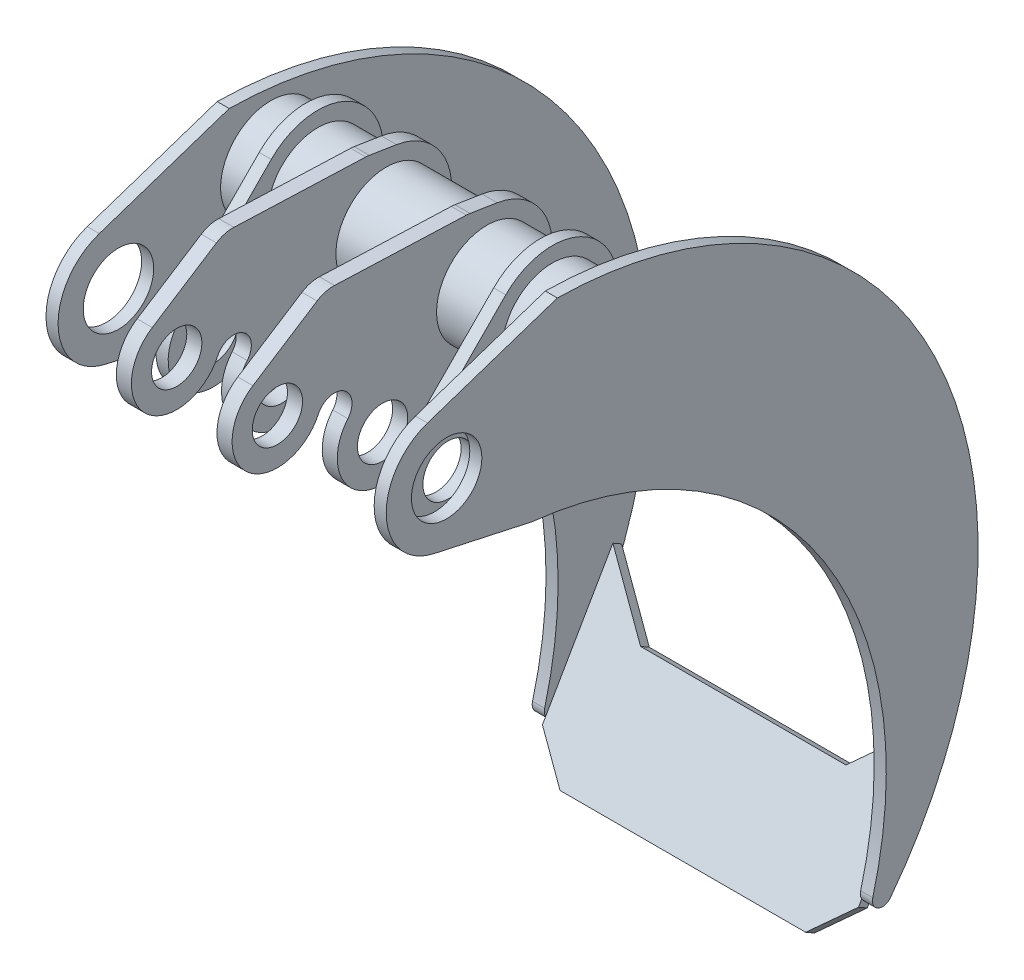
SolidWorks part; units mm, degrees
ref_plane "Ebene vorne" through (0, 0, 0) normal (0, 0, 1) x (1, 0, 0)
ref_plane "Ebene oben" through (0, 0, 0) normal (0, 1, 0) x (1, 0, 0)
ref_plane "Ebene rechts" through (0, 0, 0) normal (1, 0, 0) x (0, 0, -1)
sketch "Skizze1" plane through (0, 0, 0) normal (1, 0, 0) x (0, 0, -1)
  line L0 (-19.0085, 56.9094) -> (110, 100)
  line L1 (85, -80) -> (-12.8147, -58.6156)
  line L2 (0, 215) -> (0, -403.5076) construction
  line L3 (-634, 215) -> (-634, -403.5076) construction
  line L4 (-317, 60) -> (-317, -406.0306) construction
  line L5 (-1057, -221.2221) -> (-1057, -820.6828) construction
  line L6 (423, -221.2221) -> (423, -746.5071) construction
  line L7 (-664.6935, 100) -> (520.6037, 100) construction
  line L8 (-664.6935, 215) -> (531.2003, 215) construction
  line L9 (-811.8338, -695) -> (796.9006, -695) construction
  circle A0 centre (0, 0) radius 35
  arc A1 (-19.0085, 56.9094) -> (-12.8147, -58.6156) centre (0, 0) ccw
  arc A3 (423.3415, -572.6576) -> (440.9471, -581.3185) centre (433, -575.2486) ccw
  circle A7 centre (0, 0) radius 720 construction
  arc A8 (110, 100) -> (440.9471, -581.3185) centre (103.9883, -323.9574) cw
  arc A9 (423.3415, -572.6576) -> (85, -80) centre (43.7625, -470.8305) ccw
  point P18 (-634, 0)
  dimension "D1" = 70
  dimension "D2" = 60
  dimension "D8" = 10
  dimension "D9" = 1440
  dimension "D11" = 110
  dimension "D13" = 424
  dimension "D14" = 393
  dimension "D3" = 634
  dimension "D4" = 1480
  dimension "D5" = 100
  dimension "D6" = 115
  dimension "D7" = 910
  dimension "D10" = 180
  dimension "D12" = 85
extrude "Aufsatz-Linear austragen1" add sketch "Skizze1" along normal blind 12
sketch "Skizze2" plane through (12, 0, 0) normal (1, 0, 0) x (0, 0, -1)
  line L0 (412.3301, -621.0499) -> (499.8301, -469.4955)
  line L1 (412.3301, -621.0499) -> (403.6699, -616.0499)
  line L2 (499.8301, -469.4955) -> (491.1699, -464.4955)
  line L3 (403.6699, -616.0499) -> (491.1699, -464.4955)
  line L4 (495.5, -466.9955) -> (408, -618.5499) construction
  line L6 (423, -221.2221) -> (423, -746.5071) construction
  point P1 (433, -575.2486)
  dimension "D1" = 10
  dimension "D2" = 50
  dimension "D3" = 30
  dimension "D4" = 125
extrude "Aufsatz-Linear austragen2" add sketch "Skizze2" along normal blind 314
sketch "Skizze3" plane through (326, 0, 0) normal (1, 0, 0) x (0, 0, -1)
  line L5 (424.3397, -580.2486) -> (491.1699, -464.4955)
  line L6 (491.1699, -464.4955) -> (499.8301, -469.4955)
  line L7 (499.8301, -469.4955) -> (433, -585.2486)
  line L8 (110, 100) -> (-19.0085, 56.9094)
  line L9 (-12.8147, -58.6156) -> (85, -80)
  line L13 (110, 100) -> (-19.0085, 56.9094)
  line L14 (-12.8147, -58.6156) -> (85, -80)
  circle A0 centre (0, 0) radius 35 construction
  circle A1 centre (0, 0) radius 35
  arc A5 (433, -585.2486) -> (440.9471, -581.3185) centre (433, -575.2486) ccw
  arc A6 (440.9471, -581.3185) -> (110, 100) centre (103.9883, -323.9574) ccw
  arc A7 (-19.0085, 56.9094) -> (-12.8147, -58.6156) centre (0, 0) ccw
  arc A8 (423.3415, -572.6576) -> (85, -80) centre (43.7625, -470.8305) ccw
  arc A9 (423.3415, -572.6576) -> (424.3397, -580.2486) centre (433, -575.2486) ccw
  arc A10 (423.3415, -572.6576) -> (440.9471, -581.3185) centre (433, -575.2486) ccw
  arc A11 (440.9471, -581.3185) -> (110, 100) centre (103.9883, -323.9574) ccw
  arc A12 (-19.0085, 56.9094) -> (-12.8147, -58.6156) centre (0, 0) ccw
  arc A13 (423.3415, -572.6576) -> (85, -80) centre (43.7625, -470.8305) ccw
  dimension "D1" = 0
extrude "Aufsatz-Linear austragen3" add sketch "Skizze3" along normal blind 12
chamfer "Fase1" distance 35 angle 45 2 edges at (12, -618.5499, -408) (326, -618.5499, -408)
sketch "Skizze4" plane through (0, -333.8067, -578.1701) normal (0, -0.5, -0.866) x (-1, 0, 0)
  line L3 (-326, -296.6799) -> (-291, -331.6799) construction
  line L5 (-47, -331.6799) -> (-12, -296.6799) construction
  line L6 (-291, -331.6799) -> (-47, -331.6799) construction
  line L9 (-67, -211.6799) -> (-12, -156.6799)
  line L10 (-326, -156.6799) -> (-271, -211.6799)
  line L11 (-271, -211.6799) -> (-67, -211.6799)
  dimension "D1" = 120
extrude "Schnitt-Linear austragen1" cut sketch "Skizze4" against normal blind 10 and the other way through all
sketch "Skizze6" plane through (12, 0, 0) normal (1, 0, 0) x (0, 0, -1)
  circle A0 centre (151.4845, 36.1296) radius 50
  circle A1 centre (151.4845, 36.1296) radius 42
  circle A2 centre (0, 0) radius 155.7335 construction
  dimension "D1" = 100
  dimension "D2" = 8
  dimension "D3" = 311.4669
extrude "Aufsatz-Linear austragen8" add sketch "Skizze6" along normal up to next
ref_plane "Mitte" through (169, 0, 0) normal (1, 0, 0) x (0, 0, -1)
ref_plane "Ebene2" through (226.5, 0, 0) normal (1, 0, 0) x (0, 0, -1)
sketch "Skizze8" plane through (226.5, 0, 0) normal (1, 0, 0) x (0, 0, -1)
  line L0 (161.7254, 100.3178) -> (134.7266, 104.6253)
  line L1 (131.1428, 104.9782) -> (0.1428, 109.972)
  line L2 (-17.2162, 105.2333) -> (-80.9685, 64.273)
  line L5 (0, 0) -> (-56.6442, 26.4136) construction
  line L6 (181.4265, -21.5633) -> (68.6069, -80.1155)
  line L8 (0, 64.1869) -> (0, -109.0364) construction
  line L9 (0, 0) -> (47.8778, -40.1742) construction
  circle A0 centre (151.4845, 36.1296) radius 50 construction
  circle A1 centre (151.4845, 36.1296) radius 50
  arc A2 (181.4265, -21.5633) -> (161.7254, 100.3178) centre (151.4845, 36.1296) ccw
  arc A3 (-80.9685, 64.273) -> (-15.8604, 7.3958) centre (-56.6442, 26.4136) ccw
  arc A4 (-15.8604, 7.3958) -> (13.4058, -11.2488) centre (0, 0) cw
  arc A5 (0.1428, 109.972) -> (-17.2162, 105.2333) centre (-1, 79.9937) ccw
  arc A6 (134.7266, 104.6253) -> (131.1428, 104.9782) centre (130, 75) ccw
  circle A7 centre (-56.6442, 26.4136) radius 25
  circle A8 centre (0, 0) radius 62.5 construction
  circle A9 centre (47.8778, -40.1742) radius 25
  circle A10 centre (0, 0) radius 62 construction
  arc A11 (13.4058, -11.2488) -> (68.6069, -80.1155) centre (47.8778, -40.1742) ccw
  point P37 (-56.6442, 26.4136)
  dimension "D1" = 45
  dimension "D2" = 124
  dimension "D3" = 30
  dimension "D7" = 50
  dimension "D8" = 65
  dimension "D4" = 125
  dimension "D9" = 130
  dimension "D5" = 80
  dimension "D6" = 1
  dimension "D10" = 75
  dimension "D11" = 65
  dimension "D12" = 50
extrude "Aufsatz-Linear austragen9" add sketch "Skizze8" against normal blind 15
ref_plane "Ebene3" through (291.5, 0, 0) normal (-1, 0, 0) x (0, 0, 1)
sketch "Skizze9" plane through (291.5, 0, 0) normal (-1, 0, 0) x (0, 0, 1)
  line L0 (56.6442, 26.4136) -> (-56.6442, -26.4136) construction
  line L1 (-181.4265, -21.5633) -> (-68.6069, -80.1155) construction
  line L4 (-181.4265, -21.5633) -> (-68.6069, -80.1155)
  line L5 (-134.7266, 104.6253) -> (-161.7254, 100.3178)
  line L6 (-0.1428, 109.972) -> (-131.1428, 104.9782)
  line L7 (80.9685, 64.273) -> (17.2162, 105.2333)
  line L12 (-105.2724, 81.8401) -> (-15.8848, -8.5285)
  line L16 (-181.4265, -21.5633) -> (-68.6069, -80.1155)
  circle A0 centre (-151.4845, 36.1296) radius 50 construction
  circle A1 centre (-151.4845, 36.1296) radius 50
  circle A2 centre (56.6442, 26.4136) radius 25 construction
  circle A3 centre (56.6442, 26.4136) radius 25 construction
  circle A4 centre (0, 0) radius 62.5 construction
  arc A5 (15.8604, 7.3958) -> (-13.4058, -11.2488) centre (0, 0) ccw
  arc A6 (-161.7254, 100.3178) -> (-181.4265, -21.5633) centre (-151.4845, 36.1296) ccw
  arc A7 (-131.1428, 104.9782) -> (-134.7266, 104.6253) centre (-130, 75) ccw
  arc A8 (17.2162, 105.2333) -> (-0.1428, 109.972) centre (1, 79.9937) ccw
  arc A9 (15.8604, 7.3958) -> (80.9685, 64.273) centre (56.6442, 26.4136) ccw
  arc A17 (-105.2724, 81.8401) -> (-181.4265, -21.5633) centre (-151.4845, 36.1296) ccw
  circle A19 centre (-47.8778, -40.1742) radius 25 construction
  circle A20 centre (-47.8778, -40.1742) radius 25
  arc A21 (-68.6069, -80.1155) -> (-15.8848, -8.5285) centre (-47.8778, -40.1742) ccw
  arc A23 (-68.6069, -80.1155) -> (-13.4058, -11.2488) centre (-47.8778, -40.1742) ccw
  point P22 (0, 0)
  dimension "D1" = 0
extrude "Aufsatz-Linear austragen10" add sketch "Skizze9" along normal blind 12
mirror "Spiegeln1" about plane through (169, 0, 0) normal (1, 0, 0) of "Aufsatz-Linear austragen10", "Aufsatz-Linear austragen9"
